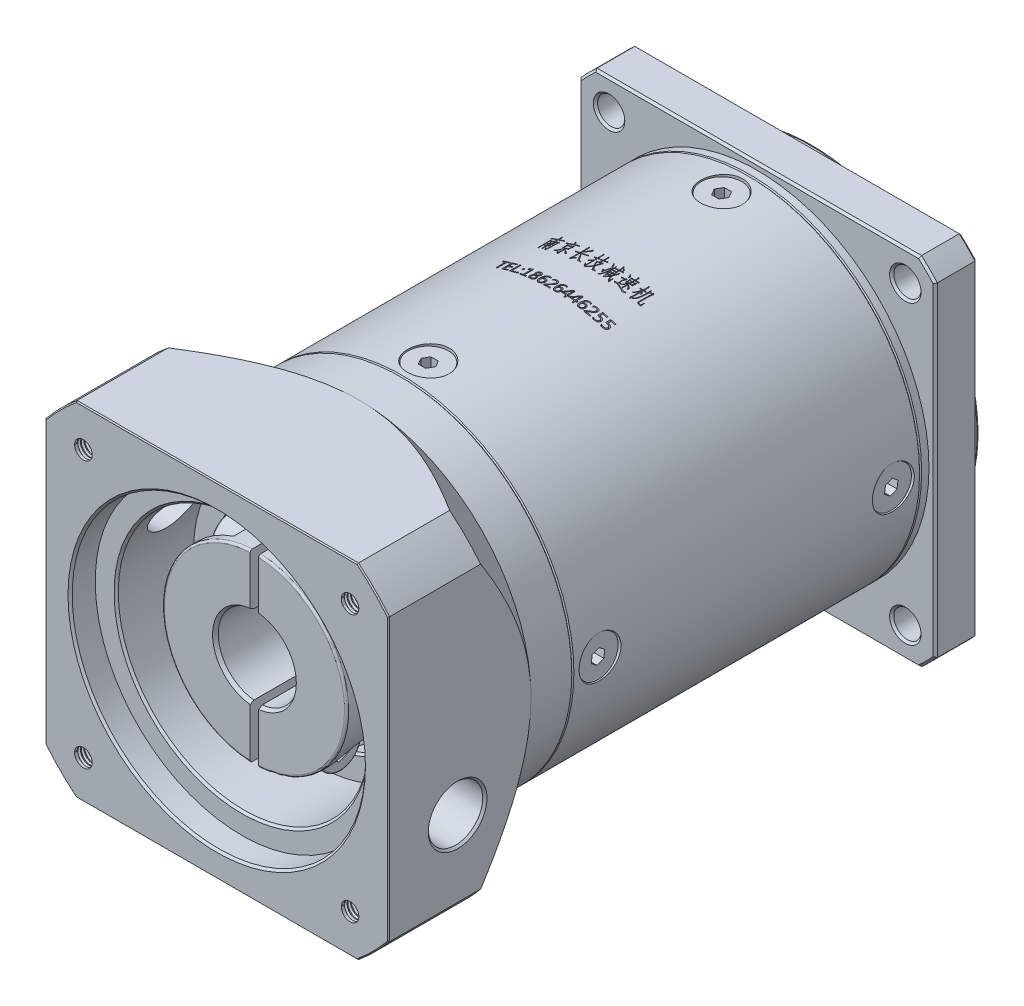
SolidWorks part; units mm, degrees
ref_plane "前视基准面" through (0, 0, 0) normal (0, 0, 1) x (1, 0, 0)
ref_plane "上视基准面" through (0, 0, 0) normal (0, 1, 0) x (1, 0, 0)
ref_plane "右视基准面" through (0, 0, 0) normal (1, 0, 0) x (0, 0, -1)
imported_body "19-70-90-M5-1-solid1"
imported_body "19-70-90-M5-1-solid2"
imported_body "19-70-90-M5-1-solid3"
imported_body "19-70-90-M5-1-solid4"
imported_body "ZF80-K15-L3-4-solid1"
imported_body "ZF80-K15-L3-4-solid2"
imported_body "ZF80-K15-L3-4-solid3"
imported_body "ZF80-K15-L3-4-solid4"
imported_body "ZF80-K15-L3-4-solid5"
imported_body "ZF80-K15-L3-4-solid6"
imported_body "ZF80-K15-L3-4-solid7"
imported_body "ZF80-K15-L3-4-solid8"
imported_body "ZF80-K15-L3-4-solid9"
sketch "草图1" plane through (0, 0, -80.9881) normal (0, 0, -1) x (-1, 0, 0)
  circle A0 centre (84.0682, 35.876) radius 11.242
  dimension "D1" = 22.484
extrude "凸台-拉伸1" add sketch "草图1" along normal blind 5
